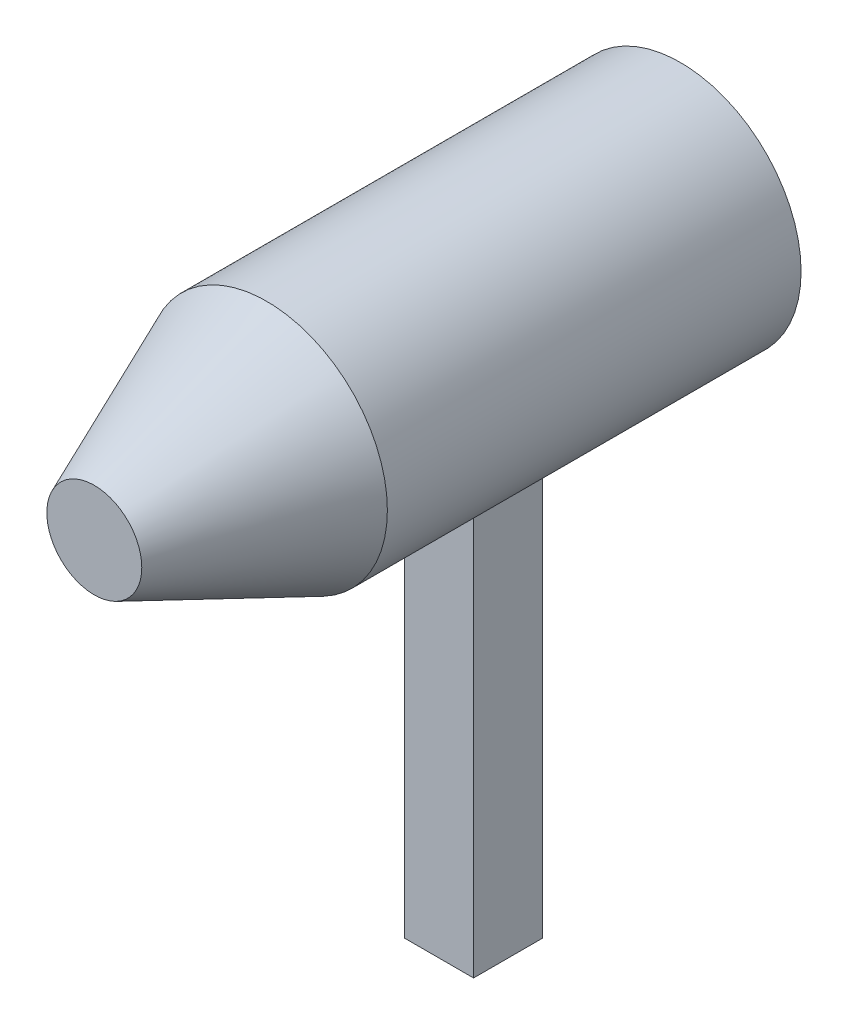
SolidWorks part; units mm, degrees
ref_plane "Front Plane" through (0, 0, 0) normal (0, 0, 1) x (1, 0, 0)
ref_plane "Top Plane" through (0, 0, 0) normal (0, 1, 0) x (1, 0, 0)
ref_plane "Right Plane" through (0, 0, 0) normal (1, 0, 0) x (0, 0, -1)
sketch "Sketch3" plane through (0, 0, 0) normal (0, 0, 1) x (1, 0, 0)
  circle A0 centre (0, 0) radius 35
  dimension "D1" = 70
extrude "Boss-Extrude2" add sketch "Sketch3" along normal blind 50.01 draft 23
sketch "Sketch4" plane through (0, 0, 0) normal (0, 0, -1) x (-1, 0, 0)
  circle A1 centre (0, 0) radius 35 construction
  circle A2 centre (0, 0) radius 35
extrude "Boss-Extrude3" add sketch "Sketch4" along normal blind 120
ref_plane "Plane1" through (0, -35, 0) normal (0, 1, 0) x (1, 0, 0)
sketch "Sketch5" plane through (0, -35, 0) normal (0, 1, 0) x (1, 0, 0)
  line L0 (35, 60) -> (0, 60) construction
  line L1 (10, 50) -> (-10, 50)
  line L2 (10, 50) -> (10, 70)
  line L3 (10, 70) -> (-10, 70)
  line L4 (-10, 50) -> (-10, 70)
  line L5 (10, 50) -> (-10, 70) construction
  line L6 (10, 70) -> (-10, 50) construction
  line L7 (35, 0) -> (35, 120) construction
  line L8 (0, 60) -> (0, 120) construction
  line L9 (35, 120) -> (-35, 120) construction
  point P0 (0, 60)
  point P9 (-18.1735, 77.1134)
  dimension "D1" = 20
  dimension "D2" = 20
extrude "Boss-Extrude4" add sketch "Sketch5" against normal blind 120 separate body
